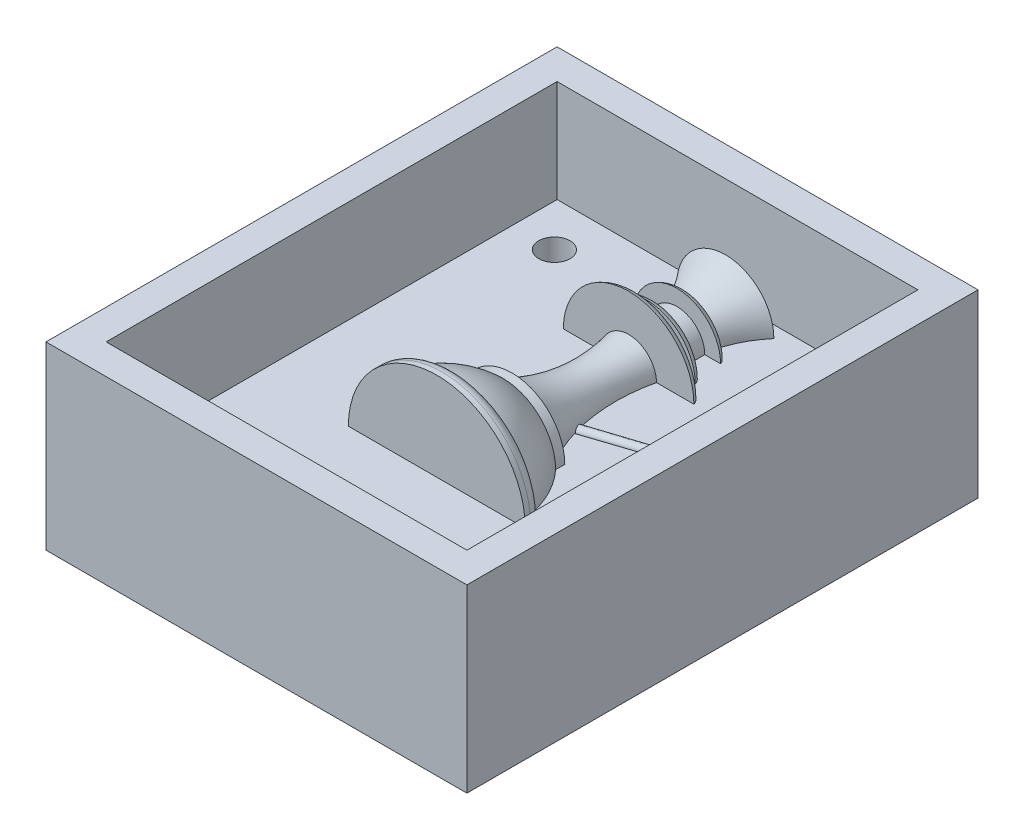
SolidWorks part; units mm, degrees
ref_plane "Front" through (0, 0, 0) normal (0, 0, 1) x (1, 0, 0)
ref_plane "Top" through (0, 0, 0) normal (0, 1, 0) x (1, 0, 0)
ref_plane "Right" through (0, 0, 0) normal (1, 0, 0) x (0, 0, -1)
sketch "Sketch1" plane through (0, 0, 0) normal (0, 1, 0) x (1, 0, 0)
  line L1 (-35, 42.5) -> (35, 42.5)
  line L2 (-35, 42.5) -> (-35, -42.5)
  line L3 (-35, -42.5) -> (35, -42.5)
  line L4 (35, 42.5) -> (35, -42.5)
  line L5 (-35, 42.5) -> (35, -42.5) construction
  line L6 (-35, -42.5) -> (35, 42.5) construction
  point P0 (0, 0)
  dimension "D1" = 70
  dimension "D2" = 85
extrude "Boss-Extrude1" add sketch "Sketch1" along normal blind 30
sketch "Sketch2" plane through (0, 30, 0) normal (0, 1, 0) x (1, 0, 0)
  line L4 (0, -37.5) -> (0, -62.5) construction
  line L8 (30, -37.5) -> (30, 37.5)
  line L9 (30, 37.5) -> (-30, 37.5)
  line L10 (-30, 37.5) -> (-30, -37.5)
  line L11 (-30, -37.5) -> (30, -37.5)
  line L12 (30, -37.5) -> (30, 37.5)
  line L13 (30, 37.5) -> (-30, 37.5)
  line L14 (-30, 37.5) -> (-30, -37.5)
  line L15 (-30, -37.5) -> (30, -37.5)
  dimension "D1" = 5
extrude "Cut-Extrude1" cut sketch "Sketch2" against normal blind 17
sketch "Sketch4" plane through (0, 13, 0) normal (0, 1, 0) x (1, 0, 0)
  line L0 (0, 42.5) -> (0, -42.5) construction
  line L1 (35, 42.5) -> (-35, 42.5) construction
  line L2 (-35, -42.5) -> (35, -42.5) construction
  line L3 (0, 37.5) -> (0, -12.5)
  line L4 (30, 37.5) -> (-30, 37.5) construction
  line L5 (0, 37.5) -> (1.76, 37.5)
  line L6 (1.76, 37.5) -> (1.76, 35.5)
  line L8 (4.6253, 28.7782) -> (7.2453, 28.7782)
  line L9 (7.2453, 28.7782) -> (7.2453, 27.4382)
  line L10 (7.2453, 27.4382) -> (4.6253, 27.4382)
  line L11 (4.6253, 27.4382) -> (4.6253, 23.8582)
  line L12 (4.6253, 23.8582) -> (8.0553, 23.8582)
  line L13 (8.0553, 23.8582) -> (8.0553, 22.4282)
  line L17 (10.8553, 20.8282) -> (10.8553, 19.3982)
  line L32 (8.0553, 22.4282) -> (4.6253, 22.4282)
  line L34 (4.6253, 20.8282) -> (10.8553, 20.8282)
  line L35 (10.8553, 19.3982) -> (4.6253, 19.3982)
  line L43 (14.7125, -12.5) -> (0, -12.5)
  line L46 (4.6253, 22.4282) -> (4.6253, 20.8282)
  line L47 (7.3563, 0) -> (8.7792, 0)
  line L48 (8.7792, 0) -> (8.7792, -1.5241)
  line L49 (14.7125, -12.5) -> (14.7125, -9.6367)
  line L50 (14.7125, -9.6367) -> (13.0634, -9.6367)
  line L52 (1.76, 35.5) -> (8.0553, 35.5)
  arc A1 (4.6253, 19.3982) -> (7.3563, 0) centre (31.5891, 13.3029) ccw
  arc A4 (8.7792, -1.5241) -> (13.0634, -9.6367) centre (-4.1307, -13.5292) cw
  arc A6 (8.0553, 35.5) -> (4.6253, 28.7782) centre (20.2085, 25.0624) ccw
  dimension "D1" = 50
  dimension "D2" = 1.76
  dimension "D3" = 2
  dimension "D6" = 2.62
  dimension "D7" = 1.34
  dimension "D8" = 2.62
  dimension "D9" = 3.58
  dimension "D10" = 3.43
  dimension "D12" = 1.43
  dimension "D16" = 1.43
revolve "Revolve2" add sketch "Sketch4" angle 360 about L0
fillet "Fillet1" radius 2 1 edges at (0, 27.7125, 9.6367)
fillet "Fillet2" radius 2 3 edges at (0, 23.8553, -20.8282) (0, 21.0553, -23.8582) (0, 20.2453, -28.7782)
sketch "Sketch5" plane through (0, 13, 0) normal (0, 1, 0) x (1, 0, 0)
  line L0 (4.9318, 5.9828) -> (30, 14.1967) construction
  line L1 (30, -37.5) -> (30, 37.5) construction
  line L6 (4.9318, 5.9828) -> (5.2389, 5.2828)
  line L7 (5.2389, 5.2828) -> (30.3275, 13.578)
  line L8 (30.3275, 13.578) -> (30, 14.1967)
  line L9 (4.9318, 5.9828) -> (30, 14.1967)
  arc A0 (4.6253, 19.3982) -> (7.3563, 0) centre (31.5891, 13.3029) ccw construction
  dimension "D1" = 0.7
  dimension "D2" = 0.7
revolve "Revolve3" add sketch "Sketch5" angle 360 about L0
sketch "Sketch6" plane through (0, 13, 0) normal (0, 1, 0) x (1, 0, 0)
  line L0 (-23, 42.5) -> (-23, -42.5) construction
  line L1 (35, 42.5) -> (-35, 42.5) construction
  line L2 (-35, -42.5) -> (35, -42.5) construction
  line L3 (23, 42.5) -> (23, -42.5) construction
  line L4 (30, 37.5) -> (-30, 37.5) construction
  line L5 (-30, -37.5) -> (30, -37.5) construction
  line L6 (30, -37.5) -> (30, 13.4697) construction
  line L7 (-30, 37.5) -> (-30, -37.5) construction
  circle A0 centre (-23, 30.0514) radius 2.6
  circle A1 centre (23, -30.5) radius 2.6
  dimension "D1" = 5.2
  dimension "D2" = 5.2
  dimension "D3" = 7.4486
  dimension "D4" = 7
  dimension "D5" = 7
  dimension "D6" = 7
extrude "Cut-Extrude2" cut sketch "Sketch6" against normal blind 5.25 contours A1 | A0
